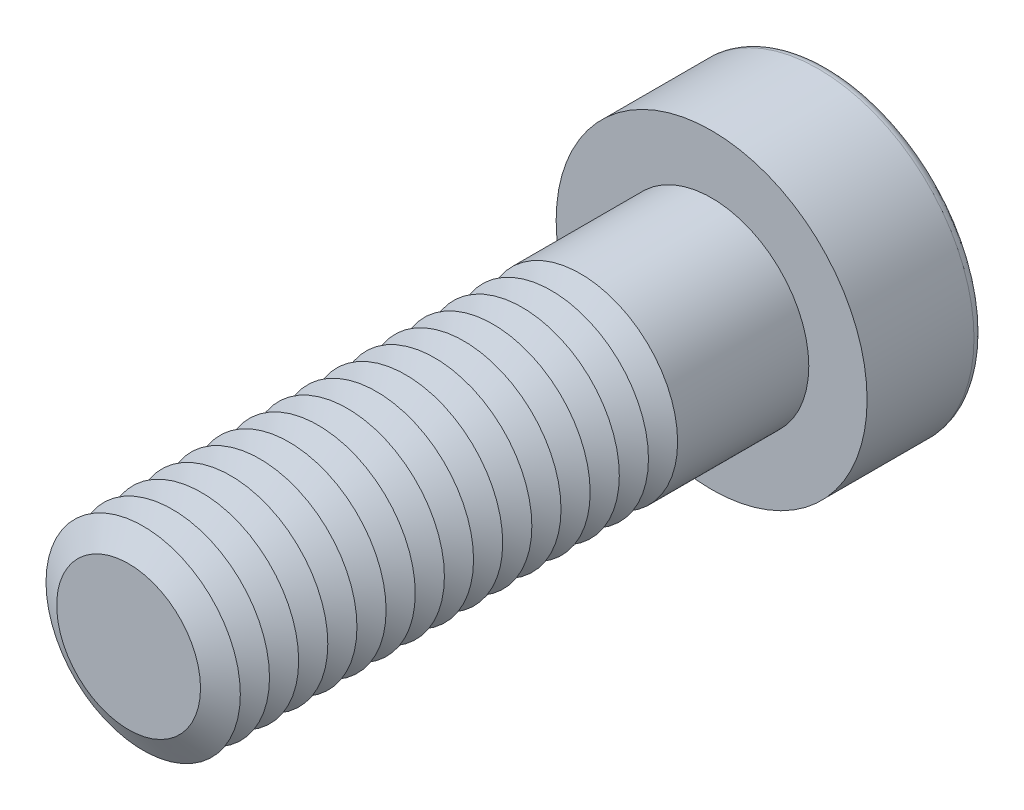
SolidWorks part; units mm, degrees
ref_plane "Front Plane" through (0, 0, 0) normal (0, 0, 1) x (1, 0, 0)
ref_plane "Top Plane" through (0, 0, 0) normal (0, 1, 0) x (1, 0, 0)
ref_plane "Right Plane" through (0, 0, 0) normal (1, 0, 0) x (0, 0, -1)
sketch "Sketch1" plane through (0, 0, 0) normal (0, 0, 1) x (1, 0, 0)
  circle A0 centre (0, 0) radius 5
  dimension "D1" = 10
extrude "Boss-Extrude1" add sketch "Sketch1" along normal blind 30
sketch "Sketch2" plane through (0, 0, 0) normal (0, 0, -1) x (-1, 0, 0)
  circle A0 centre (0, 0) radius 8
  dimension "D1" = 16
extrude "Boss-Extrude2" add sketch "Sketch2" along normal blind 6
sketch "Sketch3" plane through (0, 0, -6) normal (0, 0, -1) x (-1, 0, 0)
  line L1 (-2.0207, 3.5) -> (-4.0415, 0)
  line L2 (-4.0415, 0) -> (-2.0207, -3.5)
  line L3 (-2.0207, -3.5) -> (2.0207, -3.5)
  line L4 (2.0207, -3.5) -> (4.0415, 0)
  line L5 (4.0415, 0) -> (2.0207, 3.5)
  line L6 (2.0207, 3.5) -> (-2.0207, 3.5)
  circle A0 centre (0, 0) radius 3.5 construction
  dimension "D1" = 7
extrude "Cut-Extrude1" cut sketch "Sketch3" against normal blind 5.25
fillet "Fillet1" radius 0.5 1 edges at (-8, 0, -6)
sketch "Sketch4" plane through (0, 0, -0.75) normal (0, 0, -1) x (-1, 0, 0)
  line L0 (2.0207, -3.5) -> (4.0415, 0) construction
  circle A0 centre (0, 0) radius 3.5
extrude "Cut-Extrude2" cut sketch "Sketch4" against normal through all draft 60
sketch "Sketch5" plane through (0, 0, -6) normal (0, 0, -1) x (-1, 0, 0)
  circle A0 centre (0, 0) radius 4.0415
extrude "Cut-Extrude3" cut sketch "Sketch5" against normal through all draft 75
sketch "Sketch7" plane through (0, 0, 0) normal (1, 0, 0) x (0, 0, -1)
  line L25 (-30, 3.701) -> (-29.25, 5)
  line L26 (-30, 5) -> (-30, -5) construction
  line L27 (-29.25, 5) -> (-30.75, 5)
  line L28 (-30.75, 5) -> (-30, 3.701)
  line L29 (0, 5) -> (-30, 5) construction
  dimension "D1" = 1.5
revolve "Cut-Revolve1" cut sketch "Sketch7" angle 360 about axis through (0, 0, 30) along (0, 0, -1)
pattern_linear "LPattern1" count 16 spacing 1.5 along (0, 0, -1) of "Cut-Revolve1"
